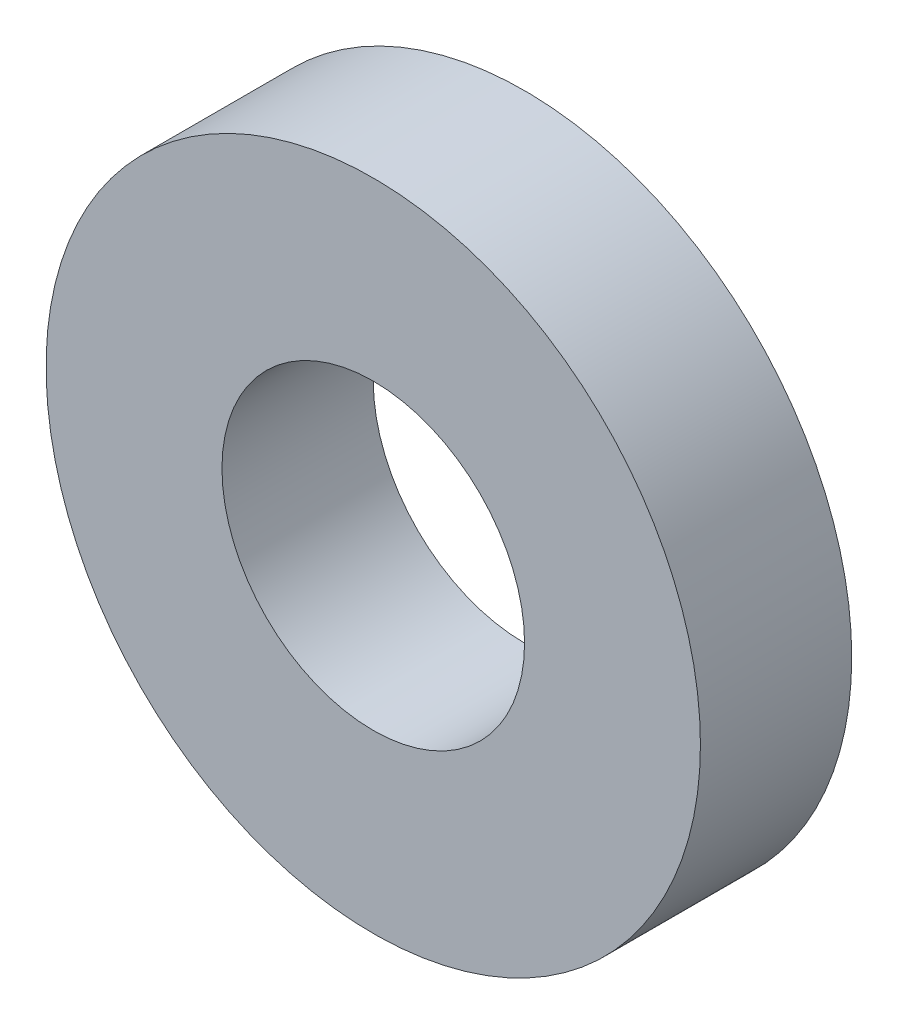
SolidWorks part; units mm, degrees
ref_plane "Face" through (0, 0, 0) normal (0, 0, 1) x (1, 0, 0)
ref_plane "Dessus" through (0, 0, 0) normal (0, 1, 0) x (1, 0, 0)
ref_plane "Droite" through (0, 0, 0) normal (1, 0, 0) x (0, 0, -1)
sketch "Esquisse1" plane through (0, 0, 0) normal (0, 0, 1) x (1, 0, 0)
  circle A0 centre (0, 0) radius 6
  circle A1 centre (0, 0) radius 12.975
  dimension "D1" = 25.95
  dimension "D2" = 12
extrude "Base-Extrusion" add sketch "Esquisse1" along normal mid plane 6
